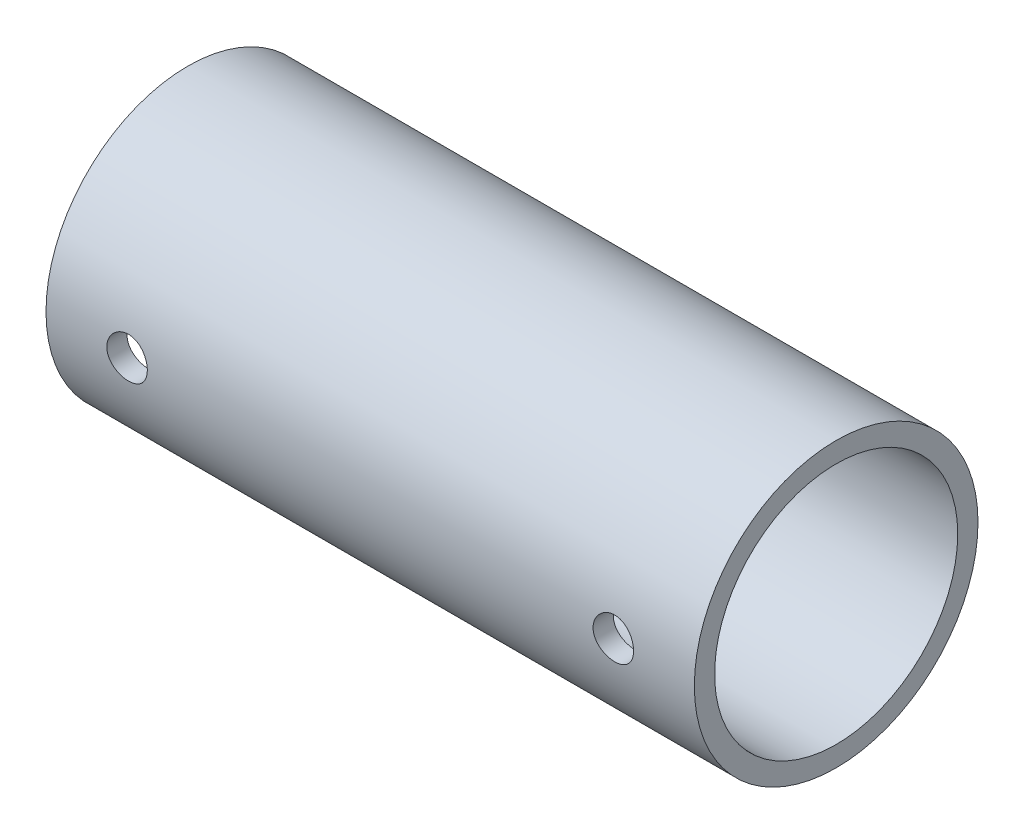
SolidWorks part; units mm, degrees
ref_plane "Front" through (0, 0, 0) normal (0, 0, 1) x (1, 0, 0)
ref_plane "Top" through (0, 0, 0) normal (0, 1, 0) x (1, 0, 0)
ref_plane "Right" through (0, 0, 0) normal (1, 0, 0) x (0, 0, -1)
sketch "Sketch1" plane through (0, 0, 0) normal (0, 0, 1) x (1, 0, 0)
  line L0 (0, 0) -> (203.2, 0)
  line L1 (9.9848, 0) -> (-9.9848, 0) construction
  dimension "D1" = 203.2
other "Structural Member1"
ref_plane "Plane1" through (0, 0, 0) normal (1, 0, 0) x (0, 0, -1)
sketch "Sketch11" plane through (0, 0, 0) normal (1, 0, 0) x (0, 0, -1)
  circle A0 centre (0, 0) radius 38.1
  circle A1 centre (0, 0) radius 44.45
  point P3 (0, 0)
  dimension "D1" = 88.9
  dimension "D2" = 76.2
ref_plane "Plane2" through (0, 0, 44.45) normal (0, 0, 1) x (1, 0, 0)
sketch "Sketch12" plane through (0, 0, 44.45) normal (0, 0, 1) x (1, 0, 0)
  line L0 (0, 0) -> (203.4563, 0) construction
  line L1 (203.2, -44.45) -> (203.2, 44.45) construction
  circle A0 centre (25.4, 0) radius 6.35
  circle A1 centre (177.8, 0) radius 6.35
  dimension "D2" = 12.7
  dimension "D3" = 12.7
  dimension "D1" = 203.4563
  dimension "D4" = 25.4
  dimension "D5" = 25.4
extrude "Cut-Extrude1" cut sketch "Sketch12" against normal blind 25.4
